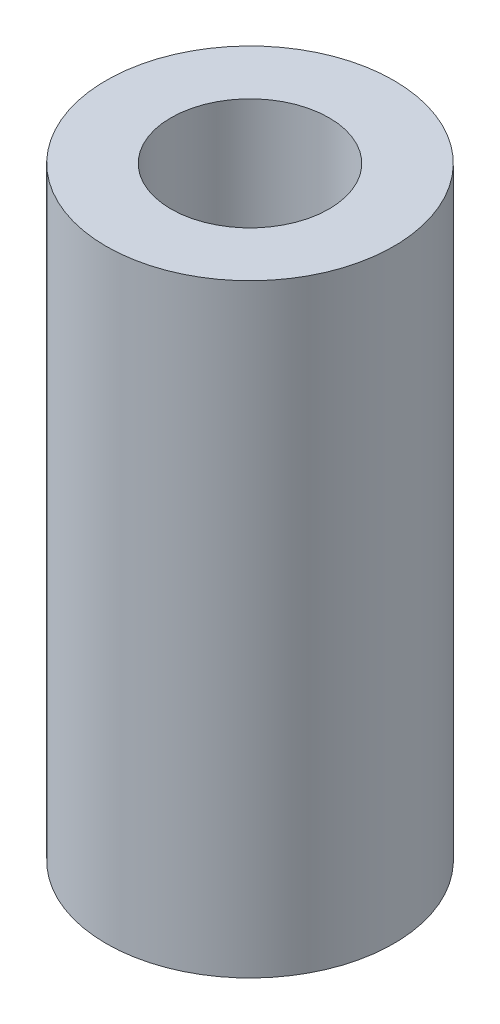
SolidWorks part; units mm, degrees
ref_plane "Front" through (0, 0, 0) normal (0, 0, 1) x (1, 0, 0)
ref_plane "Top" through (0, 0, 0) normal (0, 1, 0) x (1, 0, 0)
ref_plane "Right" through (0, 0, 0) normal (1, 0, 0) x (0, 0, -1)
sketch "Sketch1" plane through (0, 0, 0) normal (0, 1, 0) x (1, 0, 0)
  circle A0 centre (0, 0) radius 5
  circle A1 centre (0, 0) radius 2.75
extrude "Extrude1" add sketch "Sketch1" along normal blind 21
